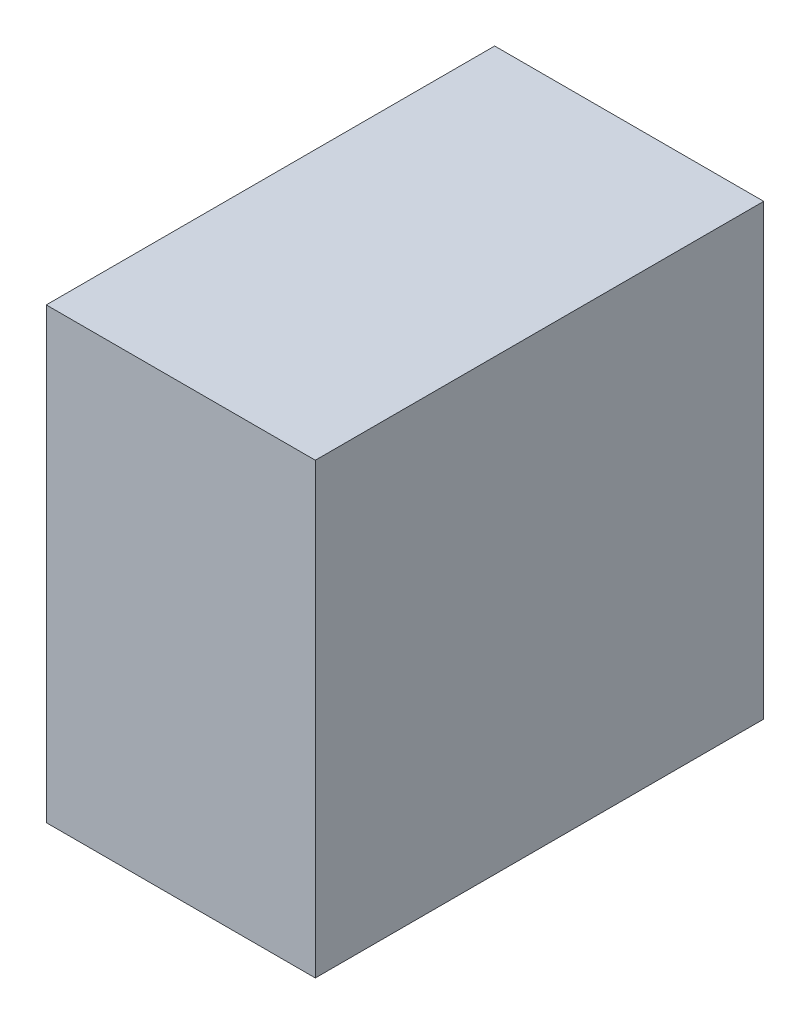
SolidWorks part; units mm, degrees
ref_plane "Face" through (0, 0, 0) normal (0, 0, 1) x (1, 0, 0)
ref_plane "Dessus" through (0, 0, 0) normal (0, 1, 0) x (1, 0, 0)
ref_plane "Droite" through (0, 0, 0) normal (1, 0, 0) x (0, 0, -1)
sketch "Esquisse1" plane through (0, 0, 0) normal (0, 0, 1) x (1, 0, 0)
  line L1 (0, 0) -> (18, 0)
  line L2 (0, 0) -> (0, 30)
  line L3 (0, 30) -> (18, 30)
  line L4 (18, 0) -> (18, 30)
  dimension "D1" = 18
  dimension "D2" = 30
extrude "Extrusion1" add sketch "Esquisse1" along normal blind 30
